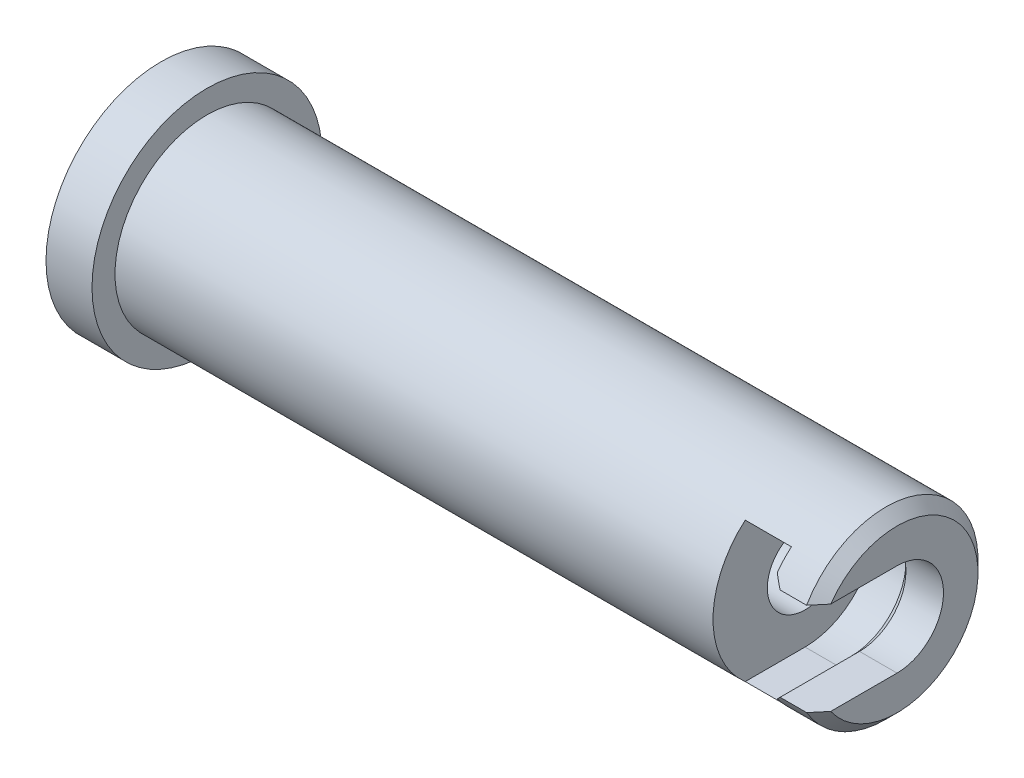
SolidWorks part; units mm, degrees
ref_plane "Front Plane" through (0, 0, 0) normal (0, 0, 1) x (1, 0, 0)
ref_plane "Top Plane" through (0, 0, 0) normal (0, 1, 0) x (1, 0, 0)
ref_plane "Right Plane" through (0, 0, 0) normal (1, 0, 0) x (0, 0, -1)
sketch "Sketch1" plane through (0, 0, 0) normal (0, 0, 1) x (1, 0, 0)
  line L0 (63.5, 0) -> (0, 0) construction
  line L1 (0, 15.875) -> (0, 6.731)
  line L2 (0, 6.731) -> (1.524, 5.207)
  line L3 (1.524, 5.207) -> (88.9, 5.207)
  line L4 (88.9, 5.207) -> (88.9, 9.652)
  line L5 (88.9, 9.652) -> (95.2754, 9.652)
  line L6 (95.2754, 9.652) -> (95.2754, 7.5565)
  line L7 (95.2754, 7.5565) -> (96.4184, 6.4135)
  line L8 (96.4184, 6.4135) -> (101.6, 6.4135)
  line L9 (101.6, 6.4135) -> (101.6, 11.176)
  line L10 (101.6, 11.176) -> (100.076, 12.7)
  line L11 (100.076, 12.7) -> (6.35, 12.7)
  line L12 (6.35, 12.7) -> (6.35, 15.875)
  line L13 (6.35, 15.875) -> (0, 15.875)
  dimension "D1" = 1.143
  dimension "Length" = 88.9
  dimension "HeadDia" = 31.75
  dimension "SleeveHeadDia" = 19.304
  dimension "ExtensionsDia" = 25.4
  dimension "D2" = 45
  dimension "SleeveHeadThickness" = 6.3754
  dimension "RefHead" = 12.7
  dimension "D3" = 1.524
  dimension "D4" = 6.35
  dimension "D5" = 1.524
  dimension "Slot" = 12.827
  dimension "D6" = 1.524
  dimension "D7" = 45
  dimension "ClearanceHole" = 10.414
revolve "Revolve1" add sketch "Sketch1" angle 360 about L0
sketch "Sketch2" plane through (0, 0, 0) normal (0, 0, 1) x (1, 0, 0)
  line L0 (88.9, -9.652) -> (95.2754, -9.652)
  line L1 (95.2754, -9.652) -> (95.2754, -7.5565)
  line L2 (95.2754, -7.5565) -> (96.4184, -6.4135)
  line L3 (96.4184, -6.4135) -> (101.6, -6.4135)
  line L4 (101.6, -6.4135) -> (101.6, 6.4135)
  line L5 (101.6, 6.4135) -> (96.4184, 6.4135)
  line L7 (95.2754, 7.5565) -> (95.2754, 9.652)
  line L8 (95.2754, 9.652) -> (88.9, 9.652)
  line L9 (88.9, 9.652) -> (88.9, -9.652)
  line L10 (60.6872, 0) -> (80.1236, 0) construction
  line L11 (101.6, -11.176) -> (101.6, 11.176) construction
  line L12 (96.4184, 6.4135) -> (95.2754, 7.5565)
  dimension "D1" = 12.7
  dimension "D2" = 45
  dimension "D3" = 45
  dimension "D4" = 1.143
  dimension "D5" = 1.143
  dimension "HalfSlot" = 6.4135
extrude "Cut-Extrude1" cut sketch "Sketch2" along normal blind 15.875
